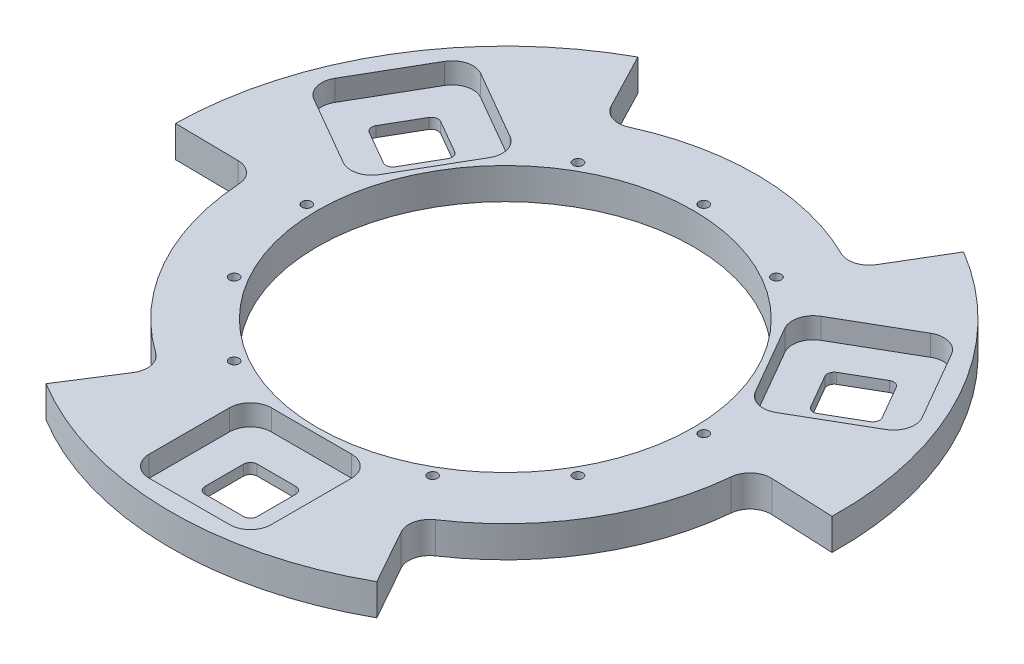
SolidWorks part; units mm, degrees
ref_plane "Front Plane" through (0, 0, 0) normal (0, 0, 1) x (1, 0, 0)
ref_plane "Top Plane" through (0, 0, 0) normal (0, 1, 0) x (1, 0, 0)
ref_plane "Right Plane" through (0, 0, 0) normal (1, 0, 0) x (0, 0, -1)
sketch "Sketch1" plane through (0, 0, 0) normal (0, 1, 0) x (1, 0, 0)
  circle A0 centre (0, 0) radius 101.6
  circle A1 centre (0, 0) radius 57.15
  dimension "D1" = 203.2
  dimension "D2" = 114.3
extrude "Boss-Extrude1" add sketch "Sketch1" along normal blind 9.525
sketch "Sketch4" plane through (0, 9.525, 0) normal (0, 1, 0) x (1, 0, 0)
  line L0 (0, -131.0486) -> (0, 122.8703) construction
  line L1 (-147.6001, 0) -> (177.198, 0) construction
  line L2 (-89.2622, 37.4428) -> (-77.0575, 58.5819)
  line L3 (12.2047, -96.0247) -> (-12.2047, -96.0247)
  line L4 (18.5547, -89.6747) -> (18.5547, -65.2653)
  line L5 (12.2047, -58.9153) -> (-12.2047, -58.9153)
  line L6 (-18.5547, -89.6747) -> (-18.5547, -65.2653)
  line L7 (18.5547, -96.0247) -> (-18.5547, -58.9153) construction
  line L8 (18.5547, -58.9153) -> (-18.5547, -96.0247) construction
  line L9 (-86.9379, 28.7685) -> (-65.7988, 16.5638)
  line L10 (-57.1245, 18.8881) -> (-44.9198, 40.0272)
  line L11 (-68.3832, 60.9062) -> (-47.2441, 48.7015)
  line L12 (-92.4372, 31.9435) -> (-41.7448, 45.5265) construction
  line L13 (-60.2995, 13.3888) -> (-73.8825, 64.0812) construction
  line L14 (77.0575, 58.5819) -> (89.2622, 37.4428)
  line L15 (68.3832, 60.9062) -> (47.2441, 48.7015)
  line L16 (44.9198, 40.0272) -> (57.1245, 18.8881)
  line L17 (86.9379, 28.7685) -> (65.7988, 16.5638)
  line L18 (73.8825, 64.0812) -> (60.2995, 13.3888) construction
  line L19 (41.7448, 45.5265) -> (92.4372, 31.9435) construction
  arc A1 (-18.5547, -89.6747) -> (-12.2047, -96.0247) centre (-12.2047, -89.6747) ccw
  arc A2 (-12.2047, -58.9153) -> (-18.5547, -65.2653) centre (-12.2047, -65.2653) ccw
  arc A3 (18.5547, -65.2653) -> (12.2047, -58.9153) centre (12.2047, -65.2653) ccw
  arc A4 (18.5547, -89.6747) -> (12.2047, -96.0247) centre (12.2047, -89.6747) cw
  arc A5 (-68.3832, 60.9062) -> (-77.0575, 58.5819) centre (-71.5582, 55.4069) ccw
  arc A6 (-44.9198, 40.0272) -> (-47.2441, 48.7015) centre (-50.4191, 43.2022) ccw
  arc A7 (-65.7988, 16.5638) -> (-57.1245, 18.8881) centre (-62.6238, 22.0631) ccw
  arc A8 (-86.9379, 28.7685) -> (-89.2622, 37.4428) centre (-83.7629, 34.2678) cw
  arc A9 (86.9379, 28.7685) -> (89.2622, 37.4428) centre (83.7629, 34.2678) ccw
  arc A10 (57.1245, 18.8881) -> (65.7988, 16.5638) centre (62.6238, 22.0631) ccw
  arc A11 (47.2441, 48.7015) -> (44.9198, 40.0272) centre (50.4191, 43.2022) ccw
  arc A12 (68.3832, 60.9062) -> (77.0575, 58.5819) centre (71.5582, 55.4069) cw
  point P5 (0, -77.47)
  point P24 (-67.091, 38.735)
  point P41 (67.091, 38.735)
  point P58 (0, 0)
  dimension "D4" = 6.35
  dimension "D1" = 37.1094
  dimension "D2" = 37.1094
  dimension "D3" = 77.47
  dimension "D5" = 3
extrude "Cut-Extrude3" cut sketch "Sketch4" against normal blind 6.35
sketch "Sketch5" plane through (0, 9.525, 0) normal (0, 1, 0) x (1, 0, 0)
  line L0 (0, -96.0247) -> (0, -58.9153) construction
  line L1 (-12.2047, -96.0247) -> (12.2047, -96.0247) construction
  line L2 (12.2047, -58.9153) -> (-12.2047, -58.9153) construction
  line L3 (18.5547, -77.47) -> (-18.5547, -77.47) construction
  line L4 (18.5547, -89.6747) -> (18.5547, -65.2653) construction
  line L5 (-18.5547, -65.2653) -> (-18.5547, -89.6747) construction
  line L6 (-76.8924, 37.6334) -> (-71.0377, 47.7741)
  line L7 (5.8547, -85.4075) -> (-5.8547, -85.4075)
  line L8 (7.9375, -83.3247) -> (7.9375, -71.6153)
  line L9 (5.8547, -69.5325) -> (-5.8547, -69.5325)
  line L10 (-7.9375, -83.3247) -> (-7.9375, -71.6153)
  line L11 (7.9375, -85.4075) -> (-7.9375, -69.5325) construction
  line L12 (7.9375, -69.5325) -> (-7.9375, -85.4075) construction
  line L13 (-76.1301, 34.7883) -> (-65.9894, 28.9336)
  line L14 (-63.1443, 29.6959) -> (-57.2896, 39.8366)
  line L15 (-68.1926, 48.5364) -> (-58.0519, 42.6817)
  line L16 (-83.1598, 48.0124) -> (-51.0221, 29.4577) construction
  line L17 (-76.3683, 22.6662) -> (-57.8136, 54.8038) construction
  line L18 (-77.9338, 35.8297) -> (-56.2482, 41.6403) construction
  line L19 (-64.1857, 27.8922) -> (-69.9963, 49.5778) construction
  line L20 (71.0377, 47.7741) -> (76.8924, 37.6334)
  line L21 (68.1926, 48.5364) -> (58.0519, 42.6817)
  line L22 (57.2896, 39.8366) -> (63.1443, 29.6959)
  line L23 (76.1301, 34.7883) -> (65.9894, 28.9336)
  line L24 (83.1598, 48.0123) -> (51.0221, 29.4576) construction
  line L25 (57.8136, 54.8038) -> (76.3683, 22.6662) construction
  line L26 (69.9963, 49.5778) -> (64.1857, 27.8922) construction
  line L27 (56.2482, 41.6403) -> (77.9338, 35.8297) construction
  arc A0 (-7.9375, -71.6153) -> (-5.8547, -69.5325) centre (-5.8547, -71.6153) cw
  arc A1 (-7.9375, -83.3247) -> (-5.8547, -85.4075) centre (-5.8547, -83.3247) ccw
  arc A2 (5.8547, -69.5325) -> (7.9375, -71.6153) centre (5.8547, -71.6153) cw
  arc A3 (7.9375, -83.3247) -> (5.8547, -85.4075) centre (5.8547, -83.3247) cw
  arc A4 (-58.0519, 42.6817) -> (-57.2896, 39.8366) centre (-59.0933, 40.878) cw
  arc A5 (-68.1926, 48.5364) -> (-71.0377, 47.7741) centre (-69.234, 46.7327) ccw
  arc A6 (-63.1443, 29.6959) -> (-65.9894, 28.9336) centre (-64.948, 30.7373) cw
  arc A7 (-76.1301, 34.7883) -> (-76.8924, 37.6334) centre (-75.0887, 36.592) cw
  arc A8 (65.9894, 28.9336) -> (63.1443, 29.6959) centre (64.948, 30.7373) cw
  arc A9 (76.1301, 34.7883) -> (76.8924, 37.6334) centre (75.0887, 36.592) ccw
  arc A10 (57.2896, 39.8366) -> (58.0519, 42.6817) centre (59.0933, 40.878) cw
  arc A11 (68.1926, 48.5364) -> (71.0377, 47.7741) centre (69.234, 46.7327) cw
  point P12 (0, -77.47)
  point P35 (-67.091, 38.735)
  point P56 (67.091, 38.735)
  point P73 (0, 0)
  dimension "D3" = 2.0828
  dimension "D1" = 15.875
  dimension "D2" = 15.875
  dimension "D4" = 3
extrude "Cut-Extrude4" cut sketch "Sketch5" against normal through all
sketch "Sketch6" plane through (0, 9.525, 0) normal (0, 1, 0) x (1, 0, 0)
  line L2 (0, 0) -> (134.0639, -2.0763) construction
  line L3 (49.6163, -88.661) -> (0, 0) construction
  line L4 (49.6163, -88.661) -> (40.1938, -71.8236)
  line L5 (101.5742, -2.2901) -> (82.4584, -1.454)
  line L6 (-101.5909, 1.3615) -> (-82.298, 1.1029)
  line L7 (-52.7704, -86.8208) -> (-42.4884, -70.6841)
  line L8 (51.9745, 87.2995) -> (42.1042, 70.7207)
  line L9 (-48.8038, 89.1109) -> (-39.97, 72.138)
  arc A1 (101.5742, -2.2901) -> (49.6163, -88.661) centre (0, 0) cw
  circle A2 centre (0, 0) radius 101.6 construction
  arc A3 (42.2171, -63.4363) -> (75.8593, -7.1981) centre (0, 0) ccw
  arc A6 (42.2171, -63.4363) -> (40.1938, -71.8236) centre (45.7351, -68.7226) ccw
  arc A7 (75.8593, -7.1981) -> (82.4584, -1.454) centre (82.1809, -7.7979) cw
  arc A8 (-52.7704, -86.8208) -> (-101.5909, 1.3615) centre (0, 0) cw
  arc A9 (-76.0459, -4.8429) -> (-44.1633, -62.097) centre (0, 0) ccw
  arc A10 (-76.0459, -4.8429) -> (-82.298, 1.1029) centre (-82.3831, -5.2465) ccw
  arc A11 (-44.1633, -62.097) -> (-42.4884, -70.6841) centre (-47.8436, -67.2718) cw
  arc A12 (-48.8038, 89.1109) -> (51.9745, 87.2995) centre (0, 0) cw
  arc A13 (33.8289, 68.2792) -> (-31.6959, 69.2951) centre (0, 0) ccw
  arc A14 (33.8289, 68.2792) -> (42.1042, 70.7207) centre (36.648, 73.9691) ccw
  arc A15 (-31.6959, 69.2951) -> (-39.97, 72.138) centre (-34.3373, 75.0697) cw
  point P12 (37.2123, -66.4958)
  point P32 (0, 0)
  dimension "D3" = 3
  dimension "D2" = 6.35
  dimension "D1" = 25.4
extrude "Cut-Extrude5" cut sketch "Sketch6" against normal through all
sketch "Sketch7" plane through (0, 9.525, 0) normal (0, 1, 0) x (1, 0, 0)
  line L1 (0, 0) -> (30.1625, 52.243) construction
  line L2 (0, 0) -> (0, 60.325) construction
  line L3 (0, 0) -> (-30.1625, 52.243) construction
  circle A0 centre (0, 0) radius 60.325 construction
  circle A1 centre (0, 60.325) radius 1.4732
  circle A2 centre (30.1625, 52.243) radius 1.4732
  circle A4 centre (-30.1625, 52.243) radius 1.4732
  circle A5 centre (30.1625, -52.243) radius 1.4732
  circle A6 centre (52.243, -30.1625) radius 1.4732
  circle A7 centre (60.325, 0) radius 1.4732
  circle A8 centre (-60.325, 0) radius 1.4732
  circle A9 centre (-52.243, -30.1625) radius 1.4732
  circle A10 centre (-30.1625, -52.243) radius 1.4732
  point P24 (0, 0)
  dimension "D1" = 120.65
  dimension "D2" = 30
  dimension "D4" = 2.9464
  dimension "D5" = 2.9464
  dimension "D6" = 2.9464
  dimension "D3" = 30
  dimension "D7" = 3
extrude "Cut-Extrude6" cut sketch "Sketch7" against normal through all
sketch "Sketch8" plane through (0, 0, 0) normal (0, -1, 0) x (1, 0, 0)
  circle A0 centre (-30.1625, -52.243) radius 2.7781
  circle A1 centre (0, -60.325) radius 2.7781
  circle A2 centre (30.1625, -52.243) radius 2.7781
  circle A3 centre (-30.1625, 52.243) radius 2.7781
  circle A4 centre (-52.243, 30.1625) radius 2.7781
  circle A5 centre (-60.325, 0) radius 2.7781
  circle A6 centre (60.325, 0) radius 2.7781
  circle A7 centre (52.243, 30.1625) radius 2.7781
  circle A8 centre (30.1625, 52.243) radius 2.7781
  point P23 (0, 0)
  dimension "D1" = 5.5562
  dimension "D2" = 5.5562
  dimension "D3" = 5.5562
  dimension "D4" = 3
extrude "Cut-Extrude7" cut sketch "Sketch8" against normal blind 3.3528
